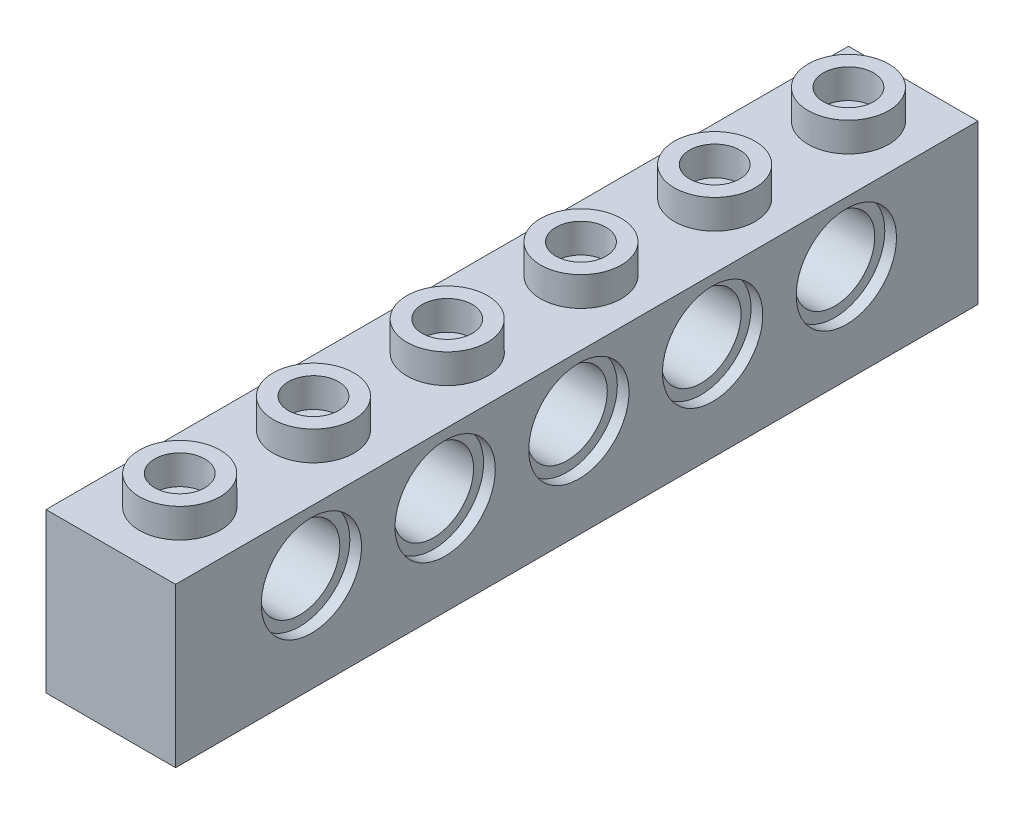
SolidWorks part; units mm, degrees
ref_plane "Front Plane" through (0, 0, 0) normal (0, 0, 1) x (1, 0, 0)
ref_plane "Top Plane" through (0, 0, 0) normal (0, 1, 0) x (1, 0, 0)
ref_plane "Right Plane" through (0, 0, 0) normal (1, 0, 0) x (0, 0, -1)
sketch "Sketch1" plane through (0, 0, 0) normal (0, 0, 1) x (1, 0, 0)
  line L1 (3.875, -4.75) -> (-3.875, -4.75)
  line L2 (3.875, -4.75) -> (3.875, 4.75)
  line L3 (3.875, 4.75) -> (-3.875, 4.75)
  line L4 (-3.875, -4.75) -> (-3.875, 4.75)
  line L5 (3.875, -4.75) -> (-3.875, 4.75) construction
  line L6 (3.875, 4.75) -> (-3.875, -4.75) construction
  point P0 (0, 0)
  dimension "D1" = 7.75
  dimension "D2" = 9.5
extrude "Boss-Extrude1" add sketch "Sketch1" along normal blind 48
sketch "Sketch2" plane through (0, 4.75, 0) normal (0, 1, 0) x (-1, 0, 0)
  line L0 (0, 0) -> (0, 48) construction
  line L1 (-3.875, 48) -> (3.875, 48) construction
  line L2 (-3.875, 0) -> (3.875, 0) construction
  circle A0 centre (0, 3.875) radius 2.415
  circle A1 centre (0, 3.875) radius 1.5
  dimension "D1" = 3
  dimension "D2" = 4.83
  dimension "D3" = 3.875
extrude "Boss-Extrude2" add sketch "Sketch2" along normal blind 1.75
sketch "Sketch3" plane through (0, 4.75, 0) normal (0, 1, 0) x (-1, 0, 0)
  line L0 (0, 0) -> (0, 67.9744) construction
sketch "Sketch4" plane through (0, 4.75, 0) normal (0, 1, 0) x (1, 0, 0)
  line L0 (0, 0) -> (0, -48) construction
  line L1 (3.875, -48) -> (-3.875, -48) construction
pattern_linear "LPattern1" count 6 spacing 8 along (0, 0, 1) of "Boss-Extrude2"
sketch "Sketch5" plane through (0, -4.75, 0) normal (0, -1, 0) x (1, 0, 0)
  line L24 (-2.425, 1.45) -> (2.425, 1.45)
  line L25 (2.425, 1.45) -> (2.425, 46.55)
  line L26 (2.425, 46.55) -> (-2.425, 46.55)
  line L27 (-2.425, 46.55) -> (-2.425, 1.45)
  line L28 (-2.425, 1.45) -> (2.425, 1.45)
  line L29 (2.425, 1.45) -> (2.425, 46.55)
  line L30 (2.425, 46.55) -> (-2.425, 46.55)
  line L31 (-2.425, 46.55) -> (-2.425, 1.45)
  dimension "D1" = 1.45
extrude "Cut-Extrude1" cut sketch "Sketch5" against normal blind 1.75
sketch "Sketch6" plane through (0, -3, 0) normal (0, -1, 0) x (1, 0, 0)
  line L0 (0, 46.55) -> (0, 1.7388) construction
  line L1 (2.425, 46.55) -> (-2.425, 46.55) construction
  line L2 (-3.875, 48) -> (3.875, 48) construction
  circle A0 centre (0, 40.4) radius 1.5
  dimension "D1" = 3
  dimension "D2" = 7.6
extrude "Boss-Extrude3" add sketch "Sketch6" along normal blind 1.75
pattern_linear "LPattern2" count 5 spacing 8 along (0, 0, -1) of "Boss-Extrude3"
sketch "Sketch7" plane through (-3.875, 0, 0) normal (-1, 0, 0) x (0, 0, 1)
  line L0 (0, 1.15) -> (48, 1.15) construction
  line L1 (0, 4.75) -> (0, -4.75) construction
  line L2 (48, 4.75) -> (48, -4.75) construction
  line L3 (48, 4.75) -> (0, 4.75) construction
  line L4 (39.875, 4.75) -> (39.875, -7.6901) construction
  line L7 (41.46, 6.5) -> (41.46, 4.75) construction
  circle A0 centre (39.875, 1.15) radius 3
  dimension "D2" = 1.585
  dimension "D3" = 6
  dimension "D1" = 3.6
extrude "Cut-Extrude2" cut sketch "Sketch7" against normal blind 0.7
sketch "Sketch8" plane through (3.875, 0, 0) normal (1, 0, 0) x (0, 0, -1)
  circle A0 centre (-39.875, 1.15) radius 3
  dimension "D1" = 6
extrude "Cut-Extrude4" cut sketch "Sketch8" against normal blind 0.7
sketch "Sketch9" plane through (-3.175, 0, 0) normal (-1, 0, 0) x (0, 0, 1)
  circle A0 centre (39.875, 1.15) radius 2.4
  dimension "D1" = 4.8
extrude "Cut-Extrude5" cut sketch "Sketch9" against normal through all
pattern_linear "LPattern3" count 5 spacing 8 along (0, 0, -1) of "Cut-Extrude5", "Cut-Extrude4", "Cut-Extrude2"
